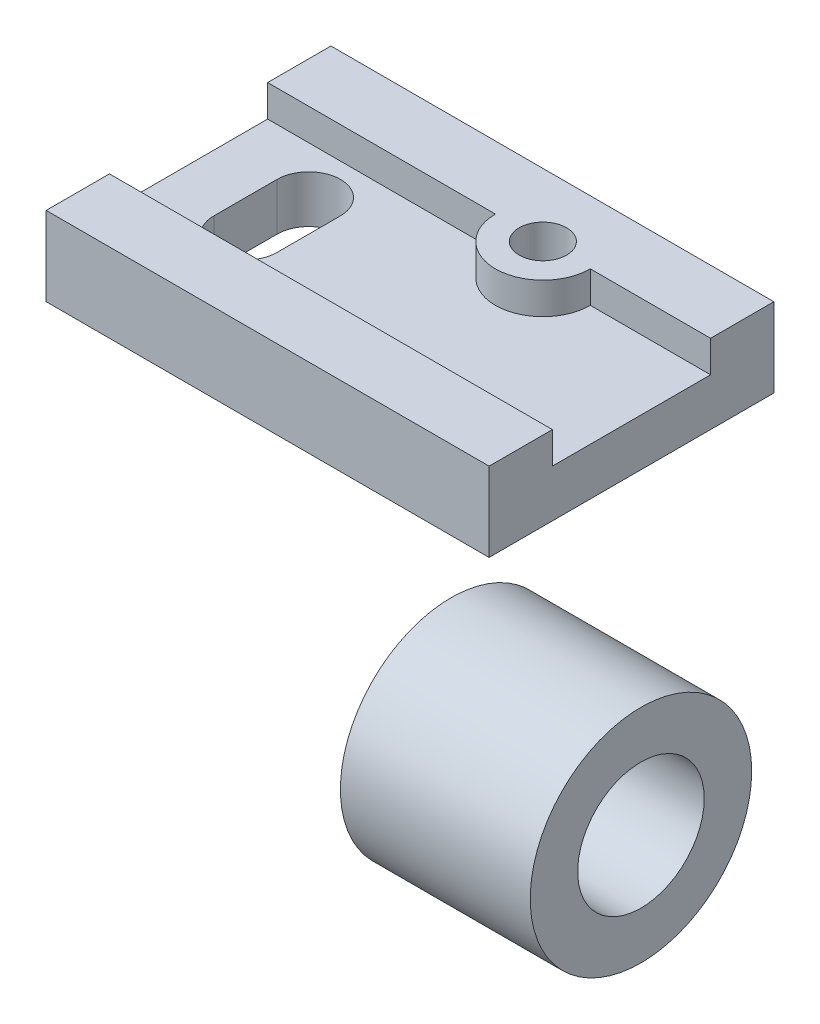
SolidWorks part; units mm, degrees
ref_plane "前视基准面" through (0, 0, 0) normal (0, 0, 1) x (1, 0, 0)
ref_plane "上视基准面" through (0, 0, 0) normal (0, 1, 0) x (1, 0, 0)
ref_plane "右视基准面" through (0, 0, 0) normal (1, 0, 0) x (0, 0, -1)
sketch "草图1" plane through (0, 0, 0) normal (0, 1, 0) x (1, 0, 0)
  line L1 (0, 0) -> (-140, 0)
  line L2 (0, 0) -> (0, -90)
  line L3 (0, -90) -> (-140, -90)
  line L4 (-140, 0) -> (-140, -90)
  dimension "D1" = 140
  dimension "D2" = 90
extrude "拉伸1" add sketch "草图1" along normal blind 25
sketch "草图2" plane through (0, 25, 0) normal (0, 1, 0) x (1, 0, 0)
  line L0 (-140, -20) -> (-68, -20)
  line L1 (-140, 0) -> (-140, -90) construction
  line L2 (-38, -20) -> (0, -20)
  line L3 (0, -90) -> (0, 0) construction
  line L4 (0, -20) -> (0, -70)
  line L5 (0, -70) -> (-140, -70)
  line L6 (-140, -70) -> (-140, -20)
  line L7 (-140, -45) -> (5.9898, -45) construction
  arc A0 (-68, -20) -> (-38, -20) centre (-53, -20) ccw
  dimension "D2" = 15
  dimension "D1" = 50
  dimension "D3" = 38
extrude "切除-拉伸1" cut sketch "草图2" against normal blind 10
sketch "草图3" plane through (0, 25, 0) normal (0, 1, 0) x (1, 0, 0)
  circle A0 centre (-53, -20) radius 7.5
  arc A1 (-68, -20) -> (-38, -20) centre (-53, -20) ccw construction
  dimension "D1" = 15
extrude "切除-拉伸2" cut sketch "草图3" against normal through all
sketch "草图4" plane through (0, 15, 0) normal (0, 1, 0) x (1, 0, 0)
  line L0 (-112, -95.5109) -> (-112, -6.5581) construction
  line L1 (-122, -35) -> (-122, -55)
  line L2 (-102, -55) -> (-102, -35)
  line L3 (-140, -20) -> (-140, -70) construction
  line L4 (-140, -45) -> (-61.954, -45) construction
  arc A0 (-122, -55) -> (-102, -55) centre (-112, -55) ccw
  arc A1 (-102, -35) -> (-122, -35) centre (-112, -35) ccw
  dimension "D3" = 10
  dimension "D1" = 28
  dimension "D2" = 20
extrude "切除-拉伸3" cut sketch "草图4" against normal through all
ref_plane "基准面1" through (-40, 0, 0) normal (1, 0, 0) x (0, 0, -1)
sketch "草图5" plane through (-40, 0, 0) normal (1, 0, 0) x (0, 0, -1)
  line L0 (0, 0) -> (-138.0282, 0) construction
  line L1 (-138.0282, 0) -> (0, 0) construction
  line L2 (0, 0) -> (0, -79.9401) construction
  circle A0 centre (-62, -80) radius 35
  circle A1 centre (-62, -80) radius 20
  dimension "D1" = 70
  dimension "D2" = 40
  dimension "D3" = 80
  dimension "D4" = 62
extrude "拉伸2" add sketch "草图5" along normal blind 60
